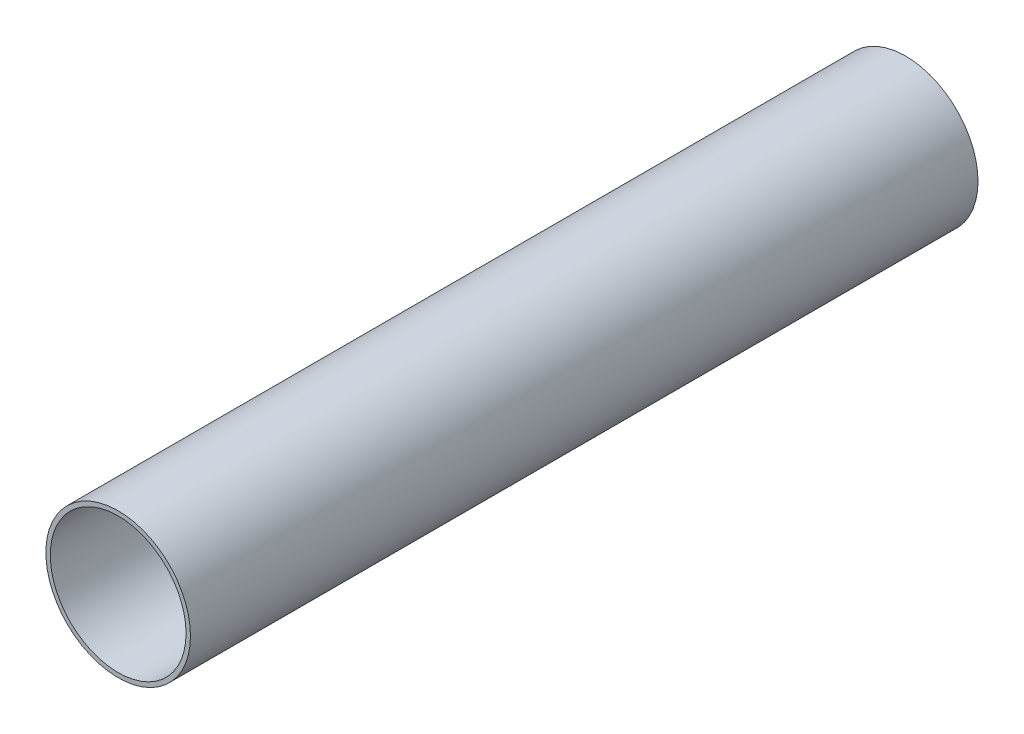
SolidWorks part; units mm, degrees
ref_plane "Front Plane" through (0, 0, 0) normal (0, 0, 1) x (1, 0, 0)
ref_plane "Top Plane" through (0, 0, 0) normal (0, 1, 0) x (1, 0, 0)
ref_plane "Right Plane" through (0, 0, 0) normal (1, 0, 0) x (0, 0, -1)
sketch "Sketch1" plane through (0, 0, 0) normal (0, 0, 1) x (1, 0, 0)
  circle A0 centre (0, 0) radius 25.4
  circle A1 centre (0, 0) radius 27.051
  dimension "D1" = 50.8
  dimension "D2" = 54.102
extrude "Extrude1" add sketch "Sketch1" along normal blind 294.64
